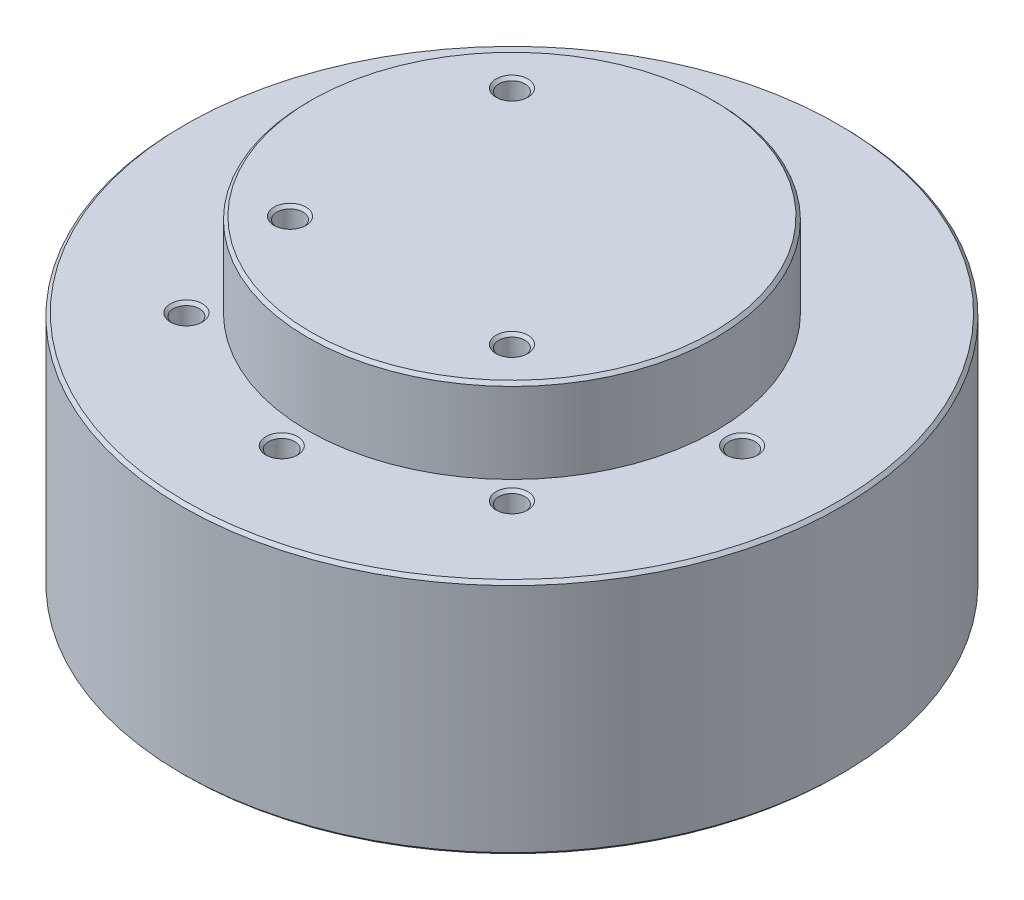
SolidWorks part; units mm, degrees
ref_plane "前视基准面" through (0, 0, 0) normal (0, 0, 1) x (1, 0, 0)
ref_plane "上视基准面" through (0, 0, 0) normal (0, 1, 0) x (1, 0, 0)
ref_plane "右视基准面" through (0, 0, 0) normal (1, 0, 0) x (0, 0, -1)
other "Configuration Table"
sketch "草图1" plane through (0, 0, 0) normal (0, 1, 0) x (1, 0, 0)
  circle A0 centre (0, 0) radius 31.5
  dimension "D1" = 63
extrude "凸台-拉伸1" add sketch "草图1" along normal blind 22.7
sketch "草图2" plane through (0, 22.7, 0) normal (0, 1, 0) x (1, 0, 0)
  circle A0 centre (0, 0) radius 19.5
  dimension "D1" = 39
extrude "凸台-拉伸2" add sketch "草图2" along normal blind 8
hole_wizard "M3 螺纹孔1" positions "草图3" profile "草图4" tap size "M3" standard "GB"
sketch "草图3" plane through (0, 0, 0) normal (0, -1, 0) x (-1, 0, 0)
  line L1 (14, -17) -> (-14, -17)
  line L2 (14, -17) -> (14, 17)
  line L3 (14, 17) -> (-14, 17)
  line L4 (-14, -17) -> (-14, 17)
  line L5 (14, -17) -> (-14, 17) construction
  line L6 (14, 17) -> (-14, -17) construction
  line L7 (-10.6066, 10.6066) -> (-10.6066, -10.6066) construction
  line L9 (-10.6066, 10.6066) -> (10.6066, 10.6066) construction
  circle A0 centre (0, 0) radius 15 construction
  circle A1 centre (0, 0) radius 12.5 construction
  point P1 (0, 0)
  point P69 (-10.6066, 10.6066)
  point P71 (10.6066, 10.6066)
  point P73 (-10.6066, -10.6066)
  point P75 (10.6066, -10.6066)
  point P98 (0, 12.5)
  point P100 (-12.5, 0)
  point P102 (0, -12.5)
  point P104 (12.5, 0)
  dimension "D3" = 30
  dimension "D4" = 25
  dimension "D1" = 28
  dimension "D2" = 34
sketch "草图4" plane through (-12.5, 0, 0) normal (1, 0, 0) x (0, 0, -1)
  line L0 (0, 0) -> (0, 8.2511)
  line L1 (0, 8.2511) -> (1.25, 7.5)
  line L2 (1.25, 7.5) -> (1.25, 0.275)
  line L3 (1.25, 0.275) -> (1.525, 0)
  line L5 (1.525, 0) -> (0, 0)
  line L6 (-1.25, 0.275) -> (-1.525, 0) construction
  line L10 (0, 8.2511) -> (-1.25, 7.5) construction
  line L11 (0, -6.35) -> (0, 107.95) construction
  dimension "螺纹孔钻头直径" = 2.5
  dimension "螺纹孔钻头深度" = 7.5
  dimension "近端锥形沉头孔直径" = 3.05
  dimension "近端锥形沉头孔角度" = 90
  dimension "导头角度" = 118
sketch "草图5" plane through (0, 30.7, 0) normal (0, 1, 0) x (1, 0, 0)
  line L0 (0, 0) -> (0, 27.4875) construction
  line L2 (-10.6066, 10.6066) -> (10.6066, -10.6066) construction
  circle A0 centre (0, 0) radius 15 construction
  point P62 (-10.6066, 10.6066)
  point P64 (-10.6066, -10.6066)
  point P66 (10.6066, -10.6066)
  point P80 (0, 0)
  point P81 (-8.0215, 9.6053)
  point P82 (0, 0)
  dimension "D2" = 30
  dimension "D1" = 45
hole_wizard "M3 螺纹孔2" positions "草图5" profile "草图6" tap size "M3" standard "GB"
sketch "草图6" plane through (10.6066, 30.7, 10.6066) normal (1, 0, 0) x (0, 0, 1)
  line L0 (0, 0) -> (0, 8.2511)
  line L1 (0, 8.2511) -> (1.25, 7.5)
  line L2 (1.25, 7.5) -> (1.25, 0.275)
  line L3 (1.25, 0.275) -> (1.525, 0)
  line L5 (1.525, 0) -> (0, 0)
  line L6 (-1.25, 0.275) -> (-1.525, 0) construction
  line L10 (0, 8.2511) -> (-1.25, 7.5) construction
  line L11 (0, -6.35) -> (0, 107.95) construction
  dimension "螺纹孔钻头直径" = 2.5
  dimension "螺纹孔钻头深度" = 7.5
  dimension "近端锥形沉头孔直径" = 3.05
  dimension "近端锥形沉头孔角度" = 90
  dimension "导头角度" = 118
hole_wizard "M3 螺纹孔3" positions "草图7" profile "草图8" tap size "M3" standard "GB"
sketch "草图7" plane through (0, 22.7, 0) normal (0, 1, 0) x (1, 0, 0)
  line L0 (0, 22) -> (0, -22) construction
  line L2 (15.5563, -15.5563) -> (0, 0) construction
  circle A0 centre (0, 0) radius 22 construction
  point P5 (-22, 0)
  point P7 (22, 0)
  point P9 (0, -22)
  point P11 (0, 22)
  point P13 (-15.5563, 15.5563)
  point P15 (-15.5563, -15.5563)
  point P17 (15.5563, -15.5563)
  dimension "D1" = 44
  dimension "D2" = 45
sketch "草图8" plane through (15.5563, 22.7, 15.5563) normal (1, 0, 0) x (0, 0, 1)
  line L0 (0, 0) -> (0, 8.2511)
  line L1 (0, 8.2511) -> (1.25, 7.5)
  line L2 (1.25, 7.5) -> (1.25, 0.275)
  line L3 (1.25, 0.275) -> (1.525, 0)
  line L5 (1.525, 0) -> (0, 0)
  line L6 (-1.25, 0.275) -> (-1.525, 0) construction
  line L10 (0, 8.2511) -> (-1.25, 7.5) construction
  line L11 (0, -6.35) -> (0, 107.95) construction
  dimension "螺纹孔钻头直径" = 2.5
  dimension "螺纹孔钻头深度" = 7.5
  dimension "近端锥形沉头孔直径" = 3.05
  dimension "近端锥形沉头孔角度" = 90
  dimension "导头角度" = 118
chamfer "倒角1" distance 0.3 angle 45 3 edges at (0, 0, 31.5) (0, 22.7, 31.5) (0, 30.7, 19.5)
sketch "草图9" plane through (0, 0, 0) normal (0, -1, 0) x (1, 0, 0)
  circle A0 centre (0, 0) radius 6.3
  dimension "D1" = 12.6
extrude "切除-拉伸1" cut sketch "草图9" against normal blind 22
